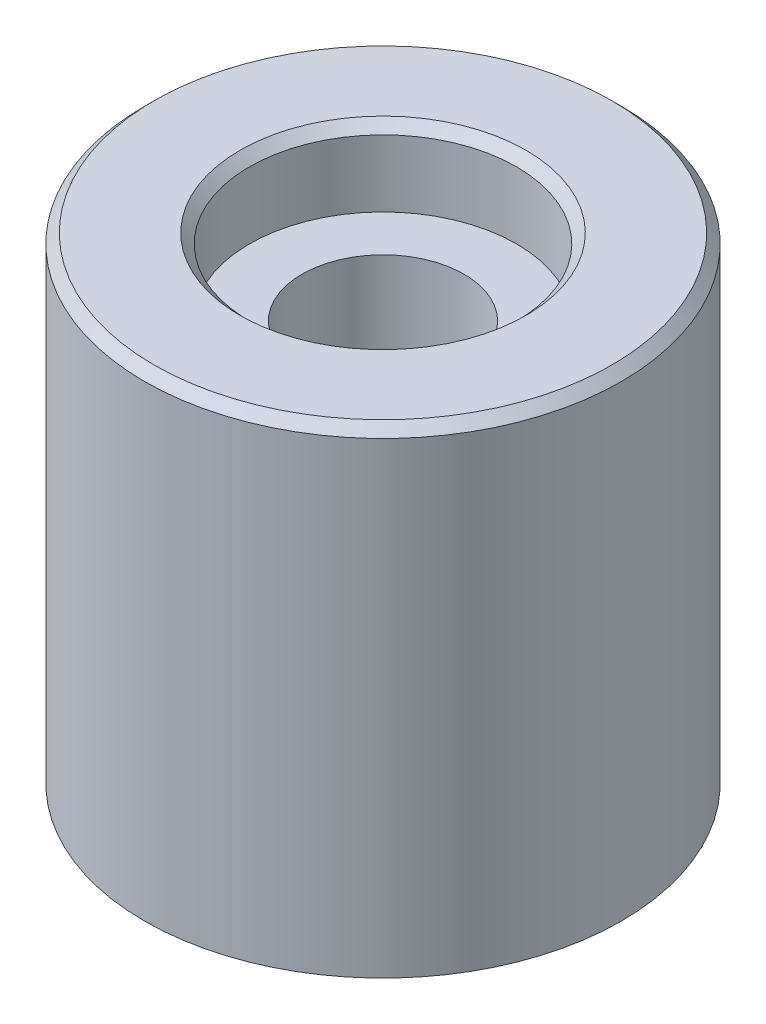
SolidWorks part; units mm, degrees
ref_plane "Plan de face" through (0, 0, 0) normal (0, 0, 1) x (1, 0, 0)
ref_plane "Plan de dessus" through (0, 0, 0) normal (0, 1, 0) x (1, 0, 0)
ref_plane "Plan de droite" through (0, 0, 0) normal (1, 0, 0) x (0, 0, -1)
sketch "Esquisse1" plane through (0, 0, 0) normal (0, 0, 1) x (1, 0, 0)
  line L0 (0, 0) -> (0, 36.5427) construction
  line L1 (-7.5, 0) -> (-7.5, 2)
  line L5 (-7.5, 2) -> (-12.5, 2)
  line L6 (-12.5, 2) -> (-12.5, 27)
  line L7 (-12.5, 27) -> (-7, 27)
  line L8 (-7, 27) -> (-7, 23)
  line L9 (-7, 23) -> (0, 23)
  line L11 (0, 23) -> (0, 0)
  line L12 (0, 0) -> (-7.5, 0)
  dimension "D1" = 25
  dimension "D2" = 14
  dimension "D3" = 25
  dimension "D4" = 15
  dimension "D5" = 2
  dimension "D6" = 4
revolve "Révolution1" add sketch "Esquisse1" angle 360 about L0
chamfer "Chanfrein1" distance 0.5 angle 45 1 edges at (0, 0, -7.5)
chamfer "Chanfrein2" distance 0.5 angle 45 2 edges at (0, 27, -7) (0, 27, -12.5)
hole_wizard "Trou pour taraudage pour trou taraudé M101" positions "Esquisse3" profile "Esquisse2" hole size "M10" standard "ISO"
sketch "Esquisse3" plane through (0, 23, 0) normal (0, 1, 0) x (1, 0, 0)
  circle A0 centre (0, 0) radius 7 construction
  point P0 (0, 0)
sketch "Esquisse2" plane through (0, 23, 0) normal (1, 0, 0) x (0, 0, 1)
  line L0 (0, 0) -> (0, 20.5537)
  line L1 (0, 20.5537) -> (4.25, 18)
  line L2 (4.25, 18) -> (4.25, 0)
  line L5 (4.25, 0) -> (0, 0)
  line L10 (0, 20.5537) -> (-4.25, 18) construction
  line L11 (0, -6.35) -> (0, 107.95) construction
  dimension "Diamètre du perçage" = 8.5
  dimension "Profondeur du perçage" = 18
  dimension "Angle de pointe" = 118
